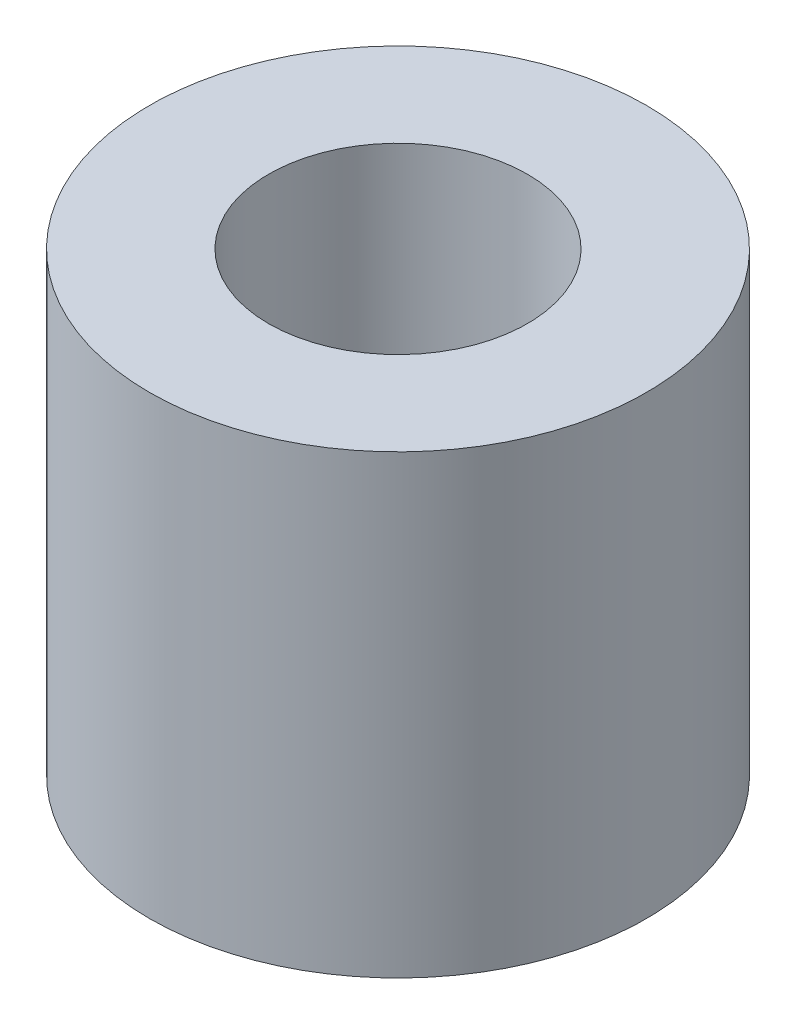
SolidWorks part; units mm, degrees
ref_plane "Front Plane" through (0, 0, 0) normal (0, 0, 1) x (1, 0, 0)
ref_plane "Top Plane" through (0, 0, 0) normal (0, 1, 0) x (1, 0, 0)
ref_plane "Right Plane" through (0, 0, 0) normal (1, 0, 0) x (0, 0, -1)
sketch "Sketch1" plane through (0, 0, 0) normal (0, 0, 1) x (1, 0, 0)
  line L0 (0, 0) -> (0, 8.3497) construction
  line L1 (-1.5875, 0) -> (-3.048, 0)
  line L2 (-3.048, 0) -> (-3.048, 5.588)
  line L3 (-3.048, 5.588) -> (-1.5875, 5.588)
  line L4 (-1.5875, 5.588) -> (-1.5875, 0)
  dimension "D1" = 3.175
  dimension "D2" = 6.096
  dimension "D3" = 5.588
revolve "Revolve1" add sketch "Sketch1" angle 360 about L0
